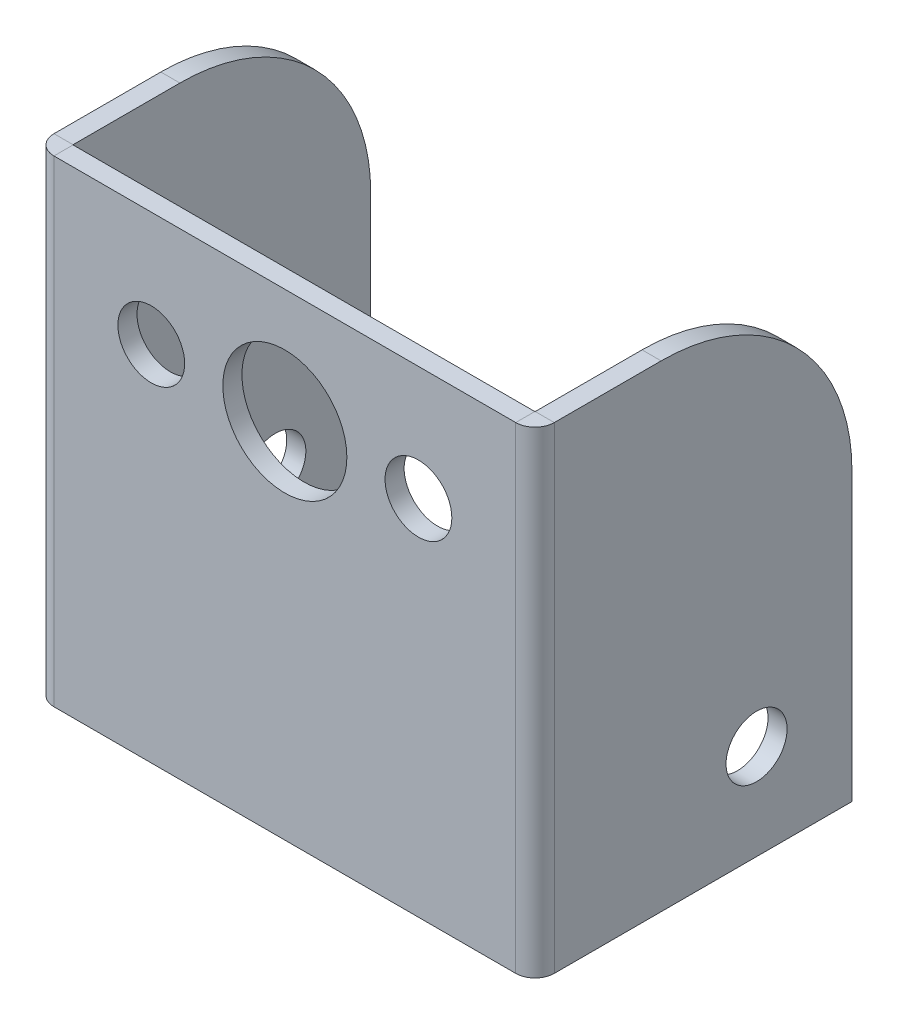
SolidWorks part; units mm, degrees
ref_plane "Front" through (0, 0, 0) normal (0, 0, 1) x (1, 0, 0)
ref_plane "Top" through (0, 0, 0) normal (0, 1, 0) x (1, 0, 0)
ref_plane "Right" through (0, 0, 0) normal (1, 0, 0) x (0, 0, -1)
sketch "Sketch1" plane through (0, 0, 0) normal (0, 0, 1) x (1, 0, 0)
  line L1 (0, 0) -> (57, 0)
  line L2 (0, 0) -> (0, 25)
  line L3 (0, 25) -> (57, 25)
  line L4 (57, 0) -> (57, 25)
  circle A0 centre (52, 5) radius 1.6
  circle A1 centre (5, 5) radius 1.6
  circle A2 centre (28.5, 19) radius 3.25
  circle A3 centre (21.5, 19) radius 1.75
  circle A4 centre (35.5, 19) radius 1.75
  dimension "D3" = 6
  dimension "D4" = 14
  dimension "D5" = 14
  dimension "D1" = 57
  dimension "D2" = 25
sheet metal parameters "Sheet-Metal1" thickness 1 parameters "D1"=0.01
base flange "Base-Flange1" sketch "Sketch1" thickness 1 reverse thickness direction yes parameters "D1"=0.01
sketch "Sketch3" plane through (0, 0, 1) normal (0, 0, 1) x (1, 0, 0)
  line L1 (41, 25) -> (41, 0)
  line L2 (16, 25) -> (16, 0)
sketched bend "Sketched Bend1" parameters "D1"=0
bend "SketchBend1" bend radius 0.01 bend angle 90 parameters "D5"=1
bend "SketchBend2" bend radius 0 bend angle 90 parameters "D5"=2
fillet "Fillet1" radius 10 2 edges at (41.1094, 25, -15.6094) (15.8906, 25, -15.6094)
flat pattern "Flat-Pattern1"
sketch "Bend-Lines1" plane through (0, 0, 1) normal (0, 0, 1) x (1, 0, 0)
  line L0 (16, 25) -> (16, 0) construction
  line L1 (41, 25) -> (41, 0) construction
bend of the flat pattern "Flatten-<SketchBend1>1"
bend of the flat pattern "Flatten-<SketchBend2>1"
